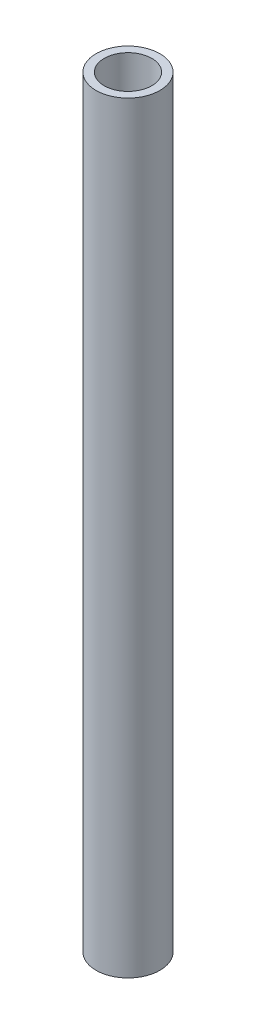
SolidWorks part; units mm, degrees
ref_plane "Front Plane" through (0, 0, 0) normal (0, 0, 1) x (1, 0, 0)
ref_plane "Top Plane" through (0, 0, 0) normal (0, 1, 0) x (1, 0, 0)
ref_plane "Right Plane" through (0, 0, 0) normal (1, 0, 0) x (0, 0, -1)
sketch "Sketch1" plane through (0, 0, 0) normal (0, 1, 0) x (1, 0, 0)
  circle A0 centre (0, 0) radius 3.9878
  circle A1 centre (0, 0) radius 2.9718
  dimension "D1" = 7.9756
  dimension "D2" = 1.016
extrude "Boss-Extrude1" add sketch "Sketch1" along normal blind 95.25
